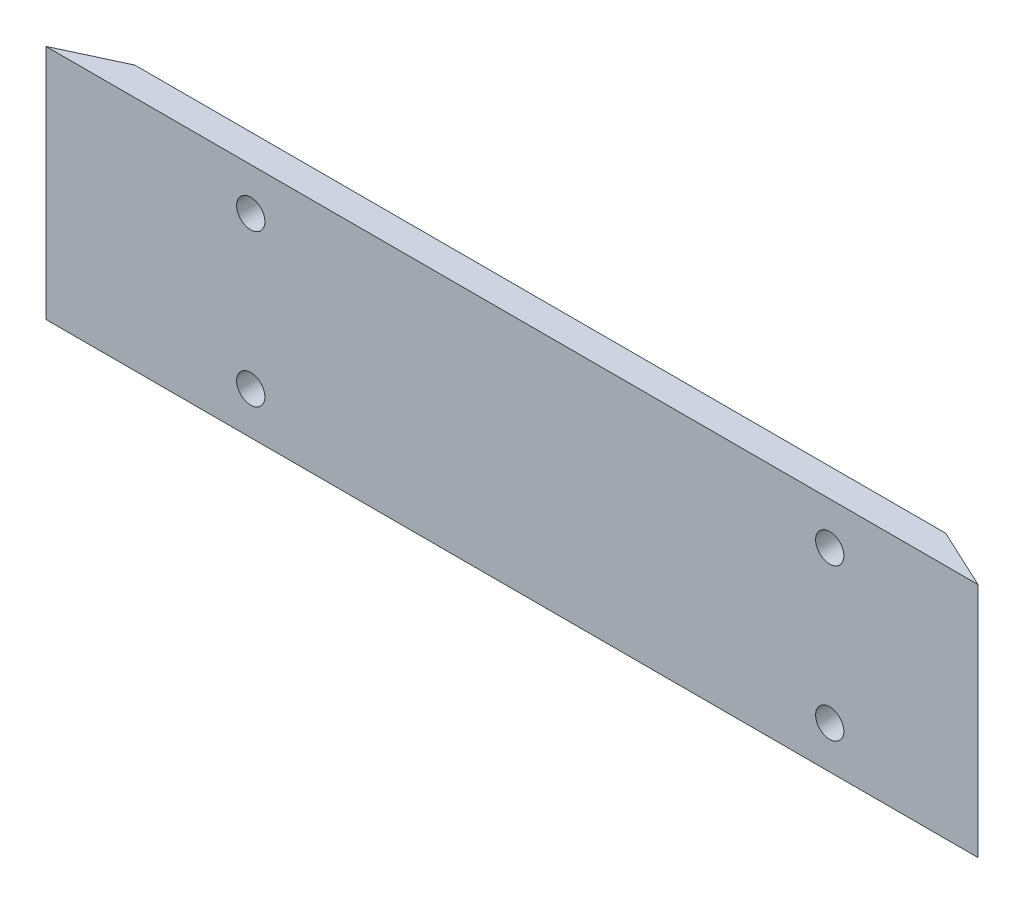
SolidWorks part; units mm, degrees
ref_plane "Front Plane" through (0, 0, 0) normal (0, 0, 1) x (1, 0, 0)
ref_plane "Top Plane" through (0, 0, 0) normal (0, 1, 0) x (1, 0, 0)
ref_plane "Right Plane" through (0, 0, 0) normal (1, 0, 0) x (0, 0, -1)
sketch "Sketch1" plane through (0, 0, 0) normal (0, 1, 0) x (1, 0, 0)
  line L0 (-444.5, -12.7) -> (393.7, -12.7)
  line L1 (393.7, -12.7) -> (339.2295, 12.7)
  line L2 (-444.5, -12.7) -> (-390.0295, 12.7)
  line L3 (-390.0295, 12.7) -> (339.2295, 12.7)
  dimension "D1" = 25.4
  dimension "D2" = 838.2
  dimension "D3" = 444.5
  dimension "D4" = 25
  dimension "D5" = 25
  dimension "D6" = 12.7
extrude "Extrude1" add sketch "Sketch1" along normal mid plane 212.725
sketch "Sketch3" plane through (0, 0, -12.7) normal (0, 0, -1) x (-1, 0, 0)
  line L0 (444.5, 106.3625) -> (-393.7, 106.3625) construction
  line L1 (444.5, 106.3625) -> (444.5, -106.3625) construction
  circle A0 centre (260.35, 68.2625) radius 4.953
  circle A1 centre (260.35, -68.2625) radius 4.953
  dimension "D1" = 9.906
  dimension "D2" = 38.1
  dimension "D3" = 184.15
  dimension "D4" = 184.15
  dimension "D5" = 136.525
extrude "Cut-Extrude2" cut sketch "Sketch3" against normal blind 6.35
sketch "Sketch4" plane through (0, 0, -6.35) normal (0, 0, -1) x (-1, 0, 0)
  circle A0 centre (260.35, -68.2625) radius 12.7
  circle A1 centre (260.35, 68.2625) radius 12.7
  dimension "D1" = 25.4
  dimension "D2" = 25.4
extrude "Cut-Extrude3" cut sketch "Sketch4" against normal through all
mirror "Mirror1" about plane through (0, 0, 0) normal (1, 0, 0) of "Cut-Extrude3", "Cut-Extrude2"
